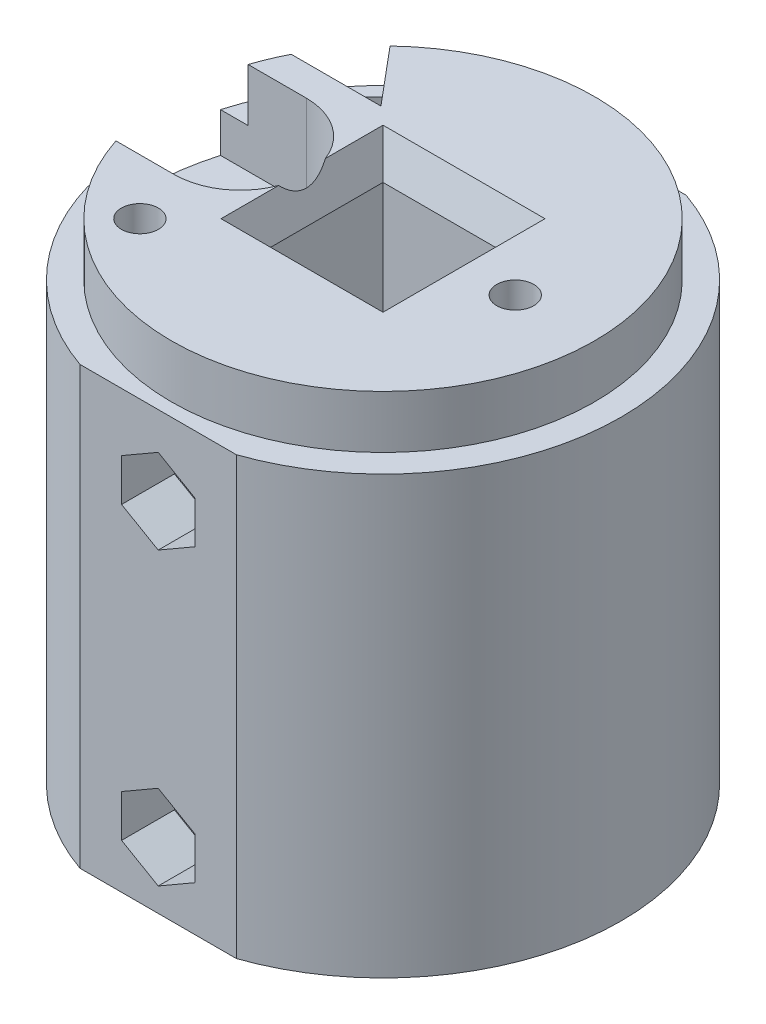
SolidWorks part; units mm, degrees
ref_plane "Спереди" through (0, 0, 0) normal (0, 0, 1) x (1, 0, 0)
ref_plane "Сверху" through (0, 0, 0) normal (0, 1, 0) x (1, 0, 0)
ref_plane "Справа" through (0, 0, 0) normal (1, 0, 0) x (0, 0, -1)
sketch "Sketch1" plane through (0, 0, 0) normal (0, 1, 0) x (1, 0, 0)
  line L0 (-5.125, 0) -> (-18, 0) construction
  line L1 (5.125, -5.125) -> (-5.125, -5.125)
  line L2 (5.125, -5.125) -> (5.125, 5.125)
  line L3 (5.125, 5.125) -> (-5.125, 5.125)
  line L4 (-5.125, -5.125) -> (-5.125, 5.125)
  line L5 (5.125, -5.125) -> (-5.125, 5.125) construction
  line L6 (5.125, 5.125) -> (-5.125, -5.125) construction
  circle A0 centre (0, 0) radius 18
  circle A1 centre (-12, 0) radius 2
  dimension "D1" = 36
  dimension "D3" = 6
  dimension "D2" = 10.25
extrude "Boss-Extrude1" add sketch "Sketch1" along normal blind 37
sketch "Sketch2" plane through (0, 37, 0) normal (0, 1, 0) x (1, 0, 0)
  line L0 (-10.8, 5) -> (-17.2916, 5)
  line L1 (-10.8, -5) -> (-17.2916, -5)
  line L2 (-5.125, 0) -> (-18, 0) construction
  line L3 (-5.125, 5.125) -> (-5.125, -5.125) construction
  circle A1 centre (0, 0) radius 18 construction
  arc A2 (-17.2916, 5) -> (-17.2916, -5) centre (0, 0) ccw
  arc A3 (-10.8, 5) -> (-10.8, -5) centre (-10.8, 0) cw
  point P12 (-5.8, 0)
  dimension "D1" = 5
extrude "Cut-Extrude1" cut sketch "Sketch2" against normal blind 7
sketch "Sketch4" plane through (0, 0, 0) normal (0, -1, 0) x (-1, 0, 0)
  line L0 (0, 0) -> (18, 21.4516) construction
  line L1 (0, 0) -> (18, -21.4516) construction
  line L2 (18, 21.4516) -> (18, -21.4516) construction
  line L3 (0, 0) -> (13.6996, 11.6756) construction
  line L4 (0, 0) -> (13.6996, -11.6756) construction
  line L5 (0, 0) -> (18, 0) construction
  line L6 (5.125, 5.125) -> (5.125, -5.125) construction
  line L7 (11.5702, 13.7888) -> (5.1423, 6.1284) construction
  line L8 (5.1423, 6.1284) -> (5.1423, -4.3826) construction
  line L9 (5.1423, -4.3826) -> (13.6996, -11.6756) construction
  line L10 (5.1423, 0.8729) -> (18.1354, 0.8729) construction
  line L12 (15.8104, 5.5479) -> (6.4604, 5.5479)
  line L13 (15.8104, 5.5479) -> (15.8104, -3.8021)
  line L14 (15.8104, -3.8021) -> (6.4604, -3.8021)
  line L15 (6.4604, 5.5479) -> (6.4604, -3.8021)
  line L16 (15.8104, 5.5479) -> (6.4604, -3.8021) construction
  line L17 (15.8104, -3.8021) -> (6.4604, 5.5479) construction
  arc A0 (13.6996, -11.6756) -> (11.5702, 13.7888) centre (0.5154, 0.0431) ccw construction
  circle A2 centre (0, 0) radius 18 construction
  point P2 (11, 0)
  point P5 (11.5702, 13.7888)
  point P7 (4.1157, 3.5076)
  point P8 (11.5702, -13.7888)
  point P11 (5.125, -6.1077)
  point P16 (11.1354, 0.8729)
  dimension "D5" = 10
  dimension "D1" = 100
  dimension "D2" = 3
  dimension "D3" = 3
  dimension "D4" = 9.35
  dimension "D6" = 7
extrude "Cut-Extrude3" cut sketch "Sketch4" against normal blind 20.4
sketch "Sketch5" plane through (0, 37, 0) normal (0, 1, 0) x (1, 0, 0)
  line L0 (0, 18) -> (0, -18) construction
  line L1 (5.9161, 17) -> (-5.9161, 17)
  line L2 (5.9161, -17) -> (-5.9161, -17)
  circle A0 centre (0, 0) radius 18 construction
  arc A1 (5.9161, 17) -> (-5.9161, 17) centre (0, 0) ccw
  arc A2 (5.9161, -17) -> (-5.9161, -17) centre (0, 0) cw
  point P11 (0, 17)
  dimension "D1" = 1
extrude "Cut-Extrude4" cut sketch "Sketch5" against normal blind 40
sketch "Sketch6" plane through (0, 0, -17) normal (0, 0, -1) x (-1, 0, 0)
  line L0 (0, 37) -> (0, 0) construction
  line L1 (5.9161, 37) -> (-5.9161, 37) construction
  line L3 (5.9161, 0) -> (-5.9161, 0) construction
  circle A0 centre (0, 27) radius 1.5
  circle A1 centre (0, 5) radius 1.5
  dimension "D1" = 3
  dimension "D2" = 10
  dimension "D3" = 5
extrude "Cut-Extrude5" cut sketch "Sketch6" against normal through all
sketch "Sketch7" plane through (0, 0, -17) normal (0, 0, -1) x (-1, 0, 0)
  circle A0 centre (0, 27) radius 3
  circle A1 centre (0, 5) radius 3
  dimension "D1" = 6
extrude "Cut-Extrude6" cut sketch "Sketch7" against normal blind 3
sketch "Sketch8" plane through (0, 0, 17) normal (0, 0, 1) x (1, 0, 0)
  line L0 (5.9161, 0) -> (5.9161, 37) construction
  line L1 (0, 23.8) -> (2.7713, 25.4)
  line L2 (2.7713, 25.4) -> (2.7713, 28.6)
  line L3 (2.7713, 28.6) -> (0, 30.2)
  line L4 (0, 30.2) -> (-2.7713, 28.6)
  line L5 (-2.7713, 28.6) -> (-2.7713, 25.4)
  line L6 (-2.7713, 25.4) -> (0, 23.8)
  line L9 (0, 1.8) -> (2.7713, 3.4)
  line L10 (2.7713, 3.4) -> (2.7713, 6.6)
  line L11 (2.7713, 6.6) -> (0, 8.2)
  line L12 (0, 8.2) -> (-2.7713, 6.6)
  line L13 (-2.7713, 6.6) -> (-2.7713, 3.4)
  line L14 (-2.7713, 3.4) -> (0, 1.8)
  circle A0 centre (0, 27) radius 3.2 construction
  circle A1 centre (0, 5) radius 3.2 construction
  dimension "D1" = 6.4
extrude "Cut-Extrude7" cut sketch "Sketch8" against normal blind 4
chamfer "Chamfer1" distance 1 angle 70 4 edges at (-5.125, 37, 0) (0, 37, -5.125) (0, 37, 5.125) (5.125, 37, 0)
sketch "Sketch9" plane through (0, 0, 0) normal (0, -1, 0) x (1, 0, 0)
  line L0 (16.4542, -7.2979) -> (-16.4542, -7.2979) construction
  line L1 (-15.8104, -5.5479) -> (-6.4604, -5.5479) construction
  line L2 (-7.4542, -7.2979) -> (-15.4542, -7.2979)
  line L3 (-7.4542, -7.2979) -> (-11.6323, -12.2772)
  line L4 (5.125, -5.125) -> (-5.125, -5.125) construction
  circle A0 centre (0, 0) radius 18 construction
  arc A1 (-15.4542, -7.2979) -> (-11.6323, -12.2772) centre (0.5168, 1.0043) ccw
  point P10 (-11.4542, -7.2979)
  dimension "D8" = 18
  dimension "D1" = 1.75
  dimension "D2" = 5
  dimension "D3" = 6.5
  dimension "D4" = 50
  dimension "D5" = 8
  dimension "D6" = 2.1729
  dimension "D7" = 23.9084
extrude "Cut-Extrude8" cut sketch "Sketch9" against normal through all
sketch "Sketch12" plane through (0, 37, 0) normal (0, 1, 0) x (1, 0, 0)
  line L0 (18, 0) -> (-10.8, 0) construction
  line L1 (0, 0) -> (-12.7279, -12.7279) construction
  arc A0 (5.9161, -17) -> (5.9161, 17) centre (0, 0) ccw construction
  arc A1 (-17.2916, -5) -> (-5.9161, -17) centre (0, 0) ccw construction
  circle A2 centre (10, 0) radius 1.4
  circle A3 centre (-9.1924, -9.1924) radius 1.4
  dimension "D1" = 2.8
  dimension "D2" = 10
  dimension "D3" = 13
extrude "Cut-Extrude10" cut sketch "Sketch12" against normal blind 20
sketch "Sketch10" plane through (0, 37, 0) normal (0, 1, 0) x (1, 0, 0)
  circle A1 centre (0, 0) radius 18
  circle A2 centre (0, 0) radius 16
  arc A3 (-17.2916, -5) -> (-5.9161, -17) centre (0, 0) ccw construction
  dimension "D1" = 2
extrude "Cut-Extrude9" cut sketch "Sketch10" against normal blind 4
